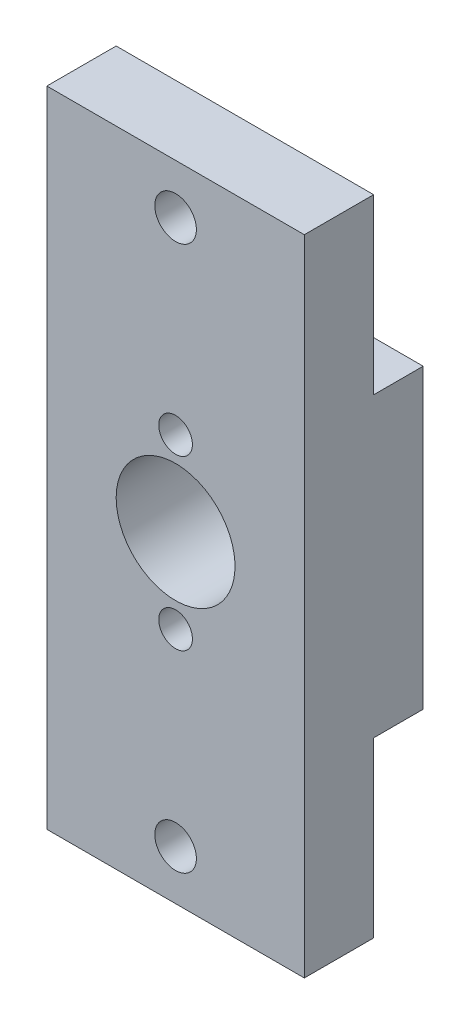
SolidWorks part; units mm, degrees
ref_plane "前视基准面" through (0, 0, 0) normal (0, 0, 1) x (1, 0, 0)
ref_plane "上视基准面" through (0, 0, 0) normal (0, 1, 0) x (1, 0, 0)
ref_plane "右视基准面" through (0, 0, 0) normal (1, 0, 0) x (0, 0, -1)
other "Configuration Table"
sketch "草图1" plane through (0, 0, 0) normal (0, 0, 1) x (1, 0, 0)
  line L1 (-15, 15) -> (15, 15)
  line L2 (-15, 15) -> (-15, -15)
  line L3 (-15, -15) -> (15, -15)
  line L4 (15, 15) -> (15, -15)
  line L5 (-15, 15) -> (15, -15) construction
  line L6 (-15, -15) -> (15, 15) construction
  point P0 (0, 0)
  dimension "D1" = 30
  dimension "D2" = 30
extrude "凸台-拉伸1" add sketch "草图1" along normal blind 5
sketch "草图2" plane through (0, 0, 5) normal (0, 0, 1) x (1, 0, 0)
  line L1 (-15, -27.5) -> (15, -27.5)
  line L2 (-15, -27.5) -> (-15, 27.5)
  line L3 (-15, 27.5) -> (15, 27.5)
  line L4 (15, -27.5) -> (15, 27.5)
  line L5 (-15, -27.5) -> (15, 27.5) construction
  line L6 (-15, 27.5) -> (15, -27.5) construction
  point P0 (0, 0)
  dimension "D1" = 30
  dimension "D2" = 55
extrude "凸台-拉伸2" add sketch "草图2" along normal blind 7
sketch "草图5" plane through (0, 0, 0) normal (0, 0, -1) x (-1, 0, 0)
  circle A0 centre (0, 0) radius 6
  dimension "D1" = 12
extrude "切除-拉伸1" cut sketch "草图5" against normal through all
hole_wizard "M3 十字槽沉头木螺钉的锥形沉头孔1" positions "草图8" profile "草图9" countersink size "M3" standard "GB"
sketch "草图8" plane through (0, 0, 0) normal (0, 0, -1) x (-1, 0, 0)
  point P0 (0, 8.5)
  point P2 (0, -8.5)
  dimension "D1" = 8.5
  dimension "D2" = 8.5
sketch "草图9" plane through (0, 8.5, 0) normal (1, 0, 0) x (0, 1, 0)
  line L0 (0, 0) -> (0, 12)
  line L1 (0, 12) -> (1.7, 12)
  line L2 (1.7, 12) -> (1.7, 1.6)
  line L3 (1.7, 1.6) -> (3.3, 0)
  line L5 (3.3, 0) -> (0, 0)
  line L6 (-1.7, 1.6) -> (-3.3, 0) construction
  line L11 (0, -6.35) -> (0, 107.95) construction
  dimension "通孔孔直径" = 3.4
  dimension "通孔孔深度" = 12
  dimension "近端锥形沉头孔直径" = 6.6
  dimension "近端锥形沉头孔角度" = 90
sketch "草图10" plane through (0, 27.5, 0) normal (0, 1, 0) x (1, 0, 0)
  line L4 (15, -5) -> (-15, -5)
  line L5 (-15, -5) -> (-15, -12)
  line L7 (15, -12) -> (15, -5)
  line L8 (15, -5) -> (-15, -5)
  line L11 (15, -12) -> (15, -5)
  line L12 (-15, -5) -> (-15, -12)
  line L14 (-15, -12) -> (15, -12)
  line L15 (-15, -12) -> (15, -12)
  dimension "D1" = 0
extrude "凸台-拉伸3" add sketch "草图10" along normal blind 5
sketch "草图11" plane through (0, -27.5, 0) normal (0, -1, 0) x (1, 0, 0)
  line L4 (-15, 5) -> (15, 5)
  line L5 (15, 5) -> (15, 12)
  line L7 (-15, 12) -> (-15, 5)
  line L8 (-15, 5) -> (15, 5)
  line L11 (-15, 12) -> (-15, 5)
  line L12 (15, 5) -> (15, 12)
  line L14 (15, 12) -> (-15, 12)
  line L15 (15, 12) -> (-15, 12)
  dimension "D1" = 0
extrude "凸台-拉伸4" add sketch "草图11" along normal blind 5
hole_wizard "M5 螺纹孔1" positions "草图12" profile "草图13" tap size "M5" standard "GB"
sketch "草图12" plane through (0, 0, 12) normal (0, 0, 1) x (1, 0, 0)
  point P0 (0, 27.5)
  point P2 (0, -27.5)
  point P10 (30.41, -12.4775)
  dimension "D1" = 27.5
  dimension "D2" = 27.5
sketch "草图13" plane through (0, 27.5, 12) normal (1, 0, 0) x (0, -1, 0)
  line L0 (0, 0) -> (0, 12)
  line L1 (0, 12) -> (2.1, 12)
  line L2 (2.1, 12) -> (2.1, 0)
  line L5 (2.1, 0) -> (0, 0)
  line L11 (0, -6.35) -> (0, 107.95) construction
  dimension "通孔螺纹孔钻头直径" = 4.2
  dimension "通孔螺纹孔钻头深度" = 12
sketch "草图14" plane through (15, 0, 0) normal (1, 0, 0) x (0, 0, -1)
  line L8 (0, -15) -> (0, 15)
  line L9 (0, 15) -> (-5, 15)
  line L10 (-5, 15) -> (-5, 32.5)
  line L11 (-5, 32.5) -> (-12, 32.5)
  line L12 (-12, 32.5) -> (-12, -32.5)
  line L13 (-12, -32.5) -> (-5, -32.5)
  line L14 (-5, -32.5) -> (-5, -15)
  line L15 (-5, -15) -> (0, -15)
  line L16 (0, -15) -> (0, 15)
  line L17 (0, 15) -> (-5, 15)
  line L18 (-5, 15) -> (-5, 32.5)
  line L19 (-5, 32.5) -> (-12, 32.5)
  line L20 (-12, 32.5) -> (-12, -32.5)
  line L21 (-12, -32.5) -> (-5, -32.5)
  line L22 (-5, -32.5) -> (-5, -15)
  line L23 (-5, -15) -> (0, -15)
  dimension "D1" = 0
extrude "切除-拉伸2" cut sketch "草图14" against normal blind 2
sketch "草图15" plane through (-15, 0, 0) normal (-1, 0, 0) x (0, 0, 1)
  line L8 (0, 15) -> (0, -15)
  line L9 (0, -15) -> (5, -15)
  line L10 (5, -15) -> (5, -32.5)
  line L11 (5, -32.5) -> (12, -32.5)
  line L12 (12, -32.5) -> (12, 32.5)
  line L13 (12, 32.5) -> (5, 32.5)
  line L14 (5, 32.5) -> (5, 15)
  line L15 (5, 15) -> (0, 15)
  line L16 (0, 15) -> (0, -15)
  line L17 (0, -15) -> (5, -15)
  line L18 (5, -15) -> (5, -32.5)
  line L19 (5, -32.5) -> (12, -32.5)
  line L20 (12, -32.5) -> (12, 32.5)
  line L21 (12, 32.5) -> (5, 32.5)
  line L22 (5, 32.5) -> (5, 15)
  line L23 (5, 15) -> (0, 15)
  dimension "D1" = 0
extrude "切除-拉伸3" cut sketch "草图15" against normal blind 2
